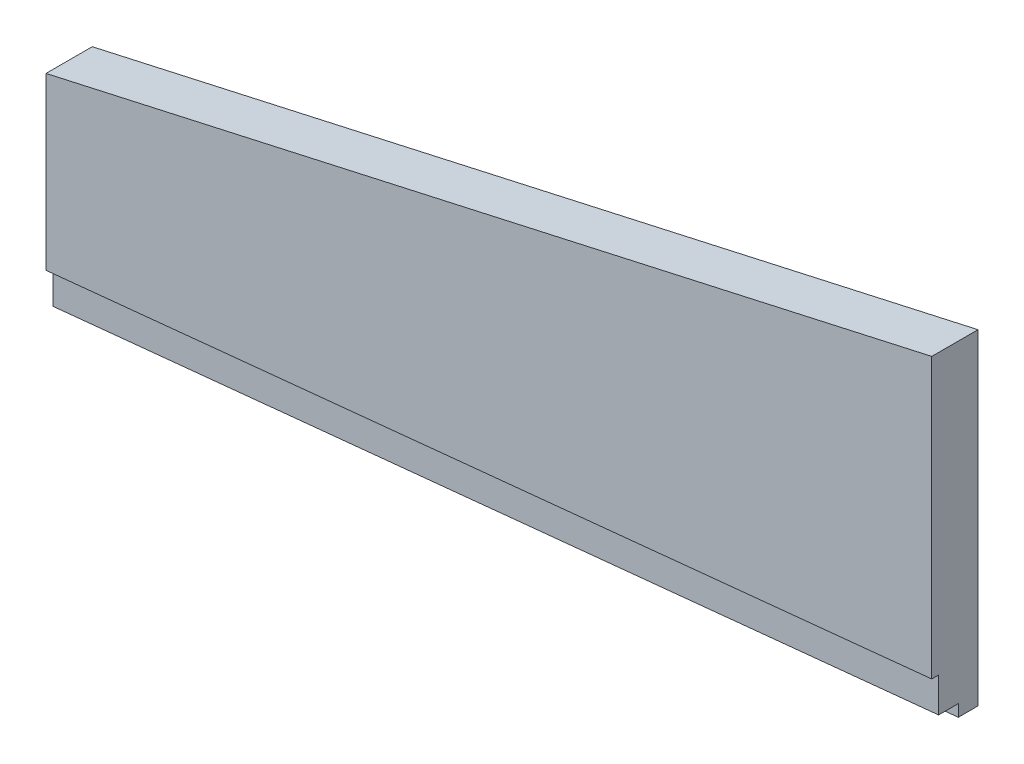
SolidWorks part; units mm, degrees
ref_plane "Спереди" through (0, 0, 0) normal (0, 0, 1) x (1, 0, 0)
ref_plane "Сверху" through (0, 0, 0) normal (0, 1, 0) x (1, 0, 0)
ref_plane "Справа" through (0, 0, 0) normal (1, 0, 0) x (0, 0, -1)
sketch "Эскиз1" plane through (0, 0, 0) normal (0, 0, 1) x (1, 0, 0)
  line L4 (0, -1226.7384) -> (0, -1510.6033)
  line L6 (-900, -1427.7191) -> (-900, -1601.0003)
  line L23 (0, -1226.7384) -> (-900, -1427.7191)
  line L27 (0, -1510.6033) -> (-900, -1601.0003)
extrude "Вытянуть1" add sketch "Эскиз1" along normal blind 47
sketch "Эскиз2" plane through (0, 0, 0) normal (0, 0, -1) x (-1, 0, 0)
  line L0 (0, -1510.6033) -> (0, -1545.7794)
  line L1 (900, -1601.0003) -> (900, -1636.1764)
  line L2 (900, -1636.1764) -> (0, -1545.7794)
  line L3 (900, -1601.0003) -> (0, -1510.6033) construction
  line L8 (900, -1427.7191) -> (0, -1226.7384)
  line L9 (0, -1226.7384) -> (0, -1510.6033)
  line L10 (0, -1510.6033) -> (900, -1601.0003)
  line L11 (900, -1601.0003) -> (900, -1427.7191)
  line L14 (0, -1510.6033) -> (900, -1601.0003)
  dimension "D1" = 35
  dimension "D2" = 0
extrude "Вытянуть2" add sketch "Эскиз2" against normal blind 40
sketch "Эскиз3" plane through (0, 0, 0) normal (0, 0, -1) x (-1, 0, 0)
  line L0 (0, -1545.7794) -> (0, -1557.8398)
  line L1 (900, -1636.1764) -> (900, -1648.2367)
  line L2 (900, -1648.2367) -> (0, -1557.8398)
  line L3 (0, -1545.7794) -> (900, -1636.1764) construction
  line L8 (900, -1427.7191) -> (0, -1226.7384)
  line L9 (0, -1226.7384) -> (0, -1545.7794)
  line L10 (0, -1545.7794) -> (900, -1636.1764)
  line L11 (900, -1636.1764) -> (900, -1427.7191)
  line L14 (0, -1545.7794) -> (900, -1636.1764)
  dimension "D1" = 12
  dimension "D2" = 0
extrude "Вытянуть3" add sketch "Эскиз3" against normal blind 20
